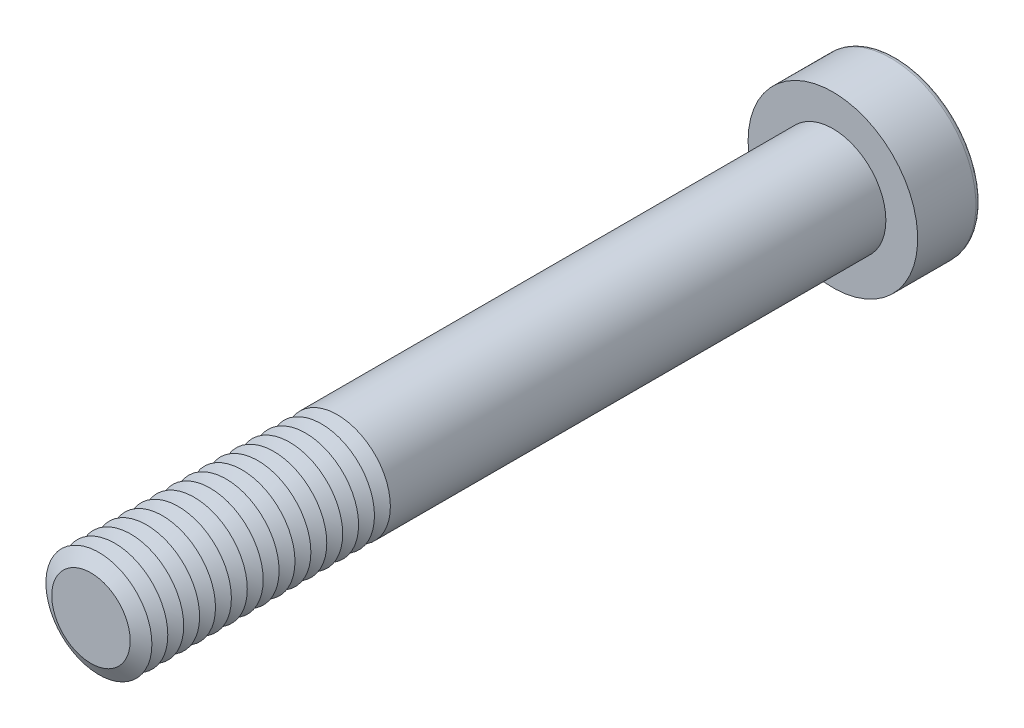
SolidWorks part; units mm, degrees
ref_plane "Front Plane" through (0, 0, 0) normal (0, 0, 1) x (1, 0, 0)
ref_plane "Top Plane" through (0, 0, 0) normal (0, 1, 0) x (1, 0, 0)
ref_plane "Right Plane" through (0, 0, 0) normal (1, 0, 0) x (0, 0, -1)
sketch "Sketch1" plane through (0, 0, 0) normal (0, 0, 1) x (1, 0, 0)
  circle A0 centre (0, 0) radius 5
  dimension "D1" = 10
extrude "Boss-Extrude1" add sketch "Sketch1" along normal blind 70
sketch "Sketch2" plane through (0, 0, 0) normal (0, 0, -1) x (-1, 0, 0)
  circle A0 centre (0, 0) radius 8
  dimension "D1" = 16
extrude "Boss-Extrude2" add sketch "Sketch2" along normal blind 6
sketch "Sketch3" plane through (0, 0, -6) normal (0, 0, -1) x (-1, 0, 0)
  line L1 (-2.0207, 3.5) -> (-4.0415, 0)
  line L2 (-4.0415, 0) -> (-2.0207, -3.5)
  line L3 (-2.0207, -3.5) -> (2.0207, -3.5)
  line L4 (2.0207, -3.5) -> (4.0415, 0)
  line L5 (4.0415, 0) -> (2.0207, 3.5)
  line L6 (2.0207, 3.5) -> (-2.0207, 3.5)
  circle A0 centre (0, 0) radius 3.5 construction
  dimension "D1" = 7
extrude "Cut-Extrude1" cut sketch "Sketch3" against normal blind 5.25
fillet "Fillet1" radius 0.5 1 edges at (-8, 0, -6)
sketch "Sketch4" plane through (0, 0, -0.75) normal (0, 0, -1) x (-1, 0, 0)
  line L0 (2.0207, -3.5) -> (4.0415, 0) construction
  circle A0 centre (0, 0) radius 3.5
extrude "Cut-Extrude2" cut sketch "Sketch4" against normal through all draft 60
sketch "Sketch5" plane through (0, 0, -6) normal (0, 0, -1) x (-1, 0, 0)
  circle A0 centre (0, 0) radius 4.0415
extrude "Cut-Extrude3" cut sketch "Sketch5" against normal through all draft 75
sketch "Sketch7" plane through (0, 0, 0) normal (1, 0, 0) x (0, 0, -1)
  line L25 (-70, 3.701) -> (-69.25, 5)
  line L26 (-70, 5) -> (-70, -5) construction
  line L27 (-69.25, 5) -> (-70.75, 5)
  line L28 (-70.75, 5) -> (-70, 3.701)
  line L29 (0, 5) -> (-70, 5) construction
  dimension "D1" = 1.5
revolve "Cut-Revolve1" cut sketch "Sketch7" angle 360 about axis through (0, 0, 70) along (0, 0, -1)
pattern_linear "LPattern1" count 16 spacing 1.5 along (0, 0, -1) of "Cut-Revolve1"
